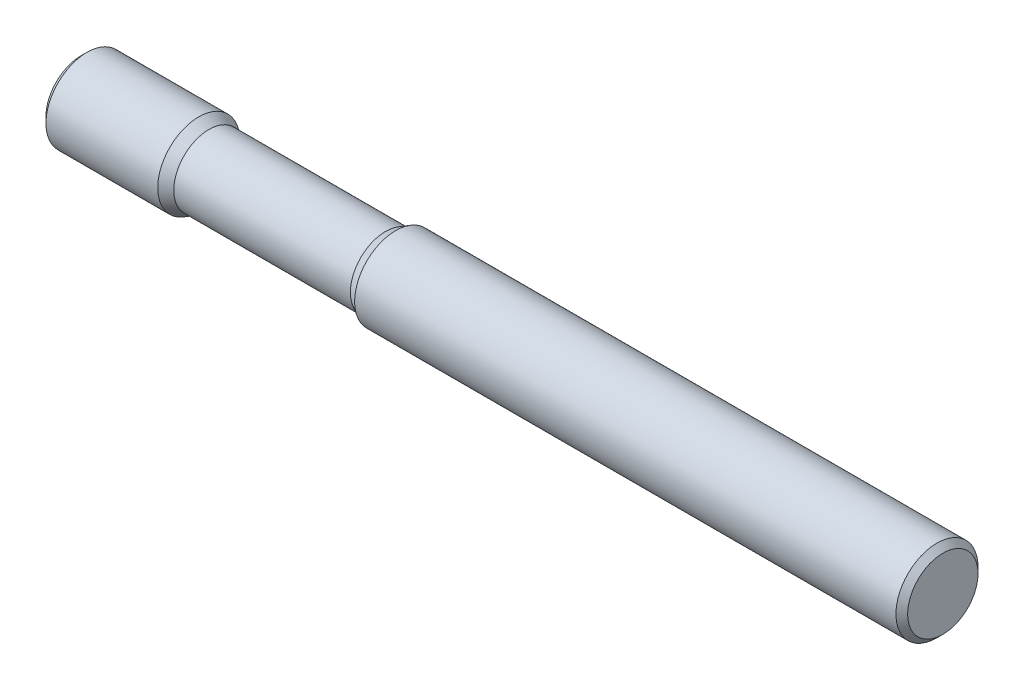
SolidWorks part; units mm, degrees
ref_plane "Plan de face" through (0, 0, 0) normal (0, 0, 1) x (1, 0, 0)
ref_plane "Plan de dessus" through (0, 0, 0) normal (0, 1, 0) x (1, 0, 0)
ref_plane "Plan de droite" through (0, 0, 0) normal (1, 0, 0) x (0, 0, -1)
ref_plane "Plan4" through (157.5, 0, 0) normal (1, 0, 0) x (0, 0, -1)
sketch "Esquisse1" plane through (0, 0, 0) normal (0, 0, 1) x (1, 0, 0)
  line L0 (0, 0) -> (0, 12.853)
  line L1 (0, 12.853) -> (2.147, 15)
  line L2 (2.147, 15) -> (43, 15)
  line L3 (43, 15) -> (46.7188, 12.853)
  line L4 (46.7188, 12.853) -> (111.2812, 12.853)
  line L5 (111.2812, 12.853) -> (115, 15)
  line L6 (115, 15) -> (312.853, 15)
  line L7 (312.853, 15) -> (315, 12.853)
  line L8 (315, 12.853) -> (315, 0)
  line L9 (315, 0) -> (0, 0)
  line L10 (315, 0) -> (0, 0) construction
revolve "Révolution1" add sketch "Esquisse1" angle 360 about L10
ref_plane "Plan5" through (314.999, 0, 0) normal (1, 0, 0) x (0, 0, -1)
